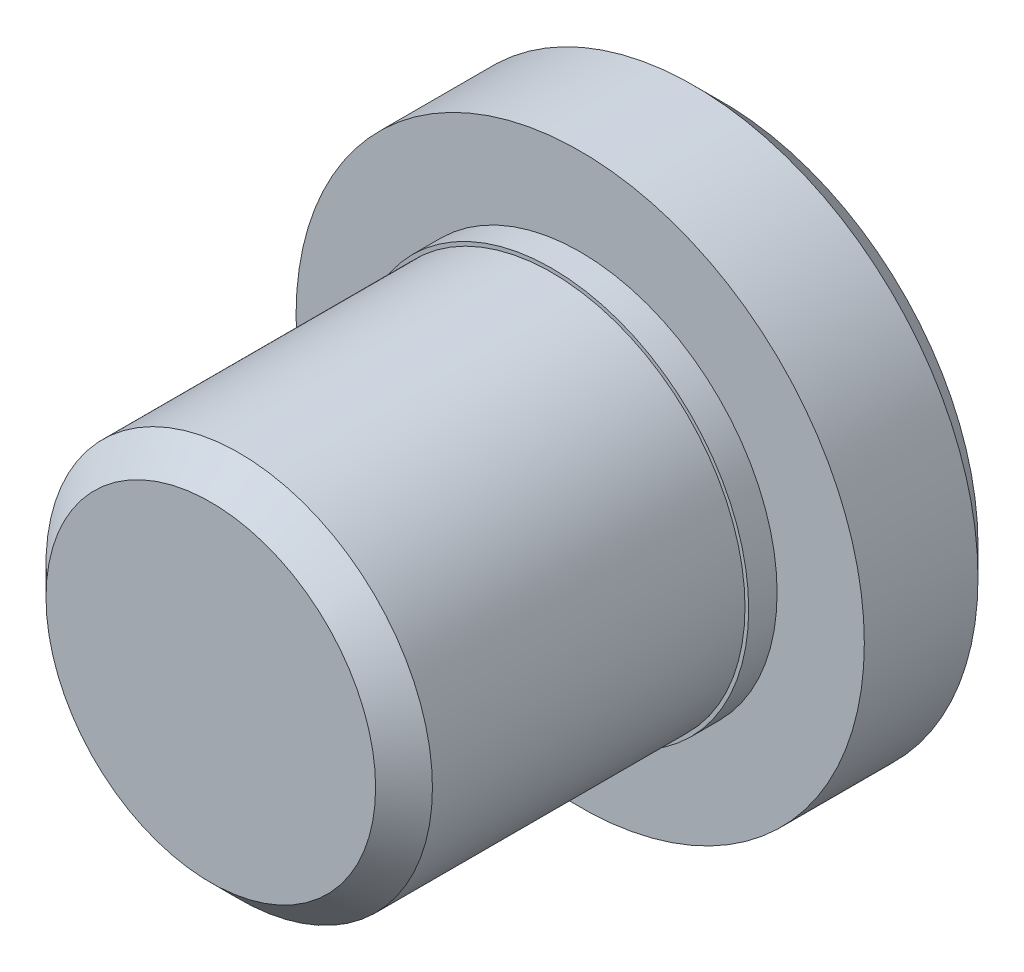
SolidWorks part; units mm, degrees
ref_plane "Piano frontale" through (0, 0, 0) normal (0, 0, 1) x (1, 0, 0)
ref_plane "Piano superiore" through (0, 0, 0) normal (0, 1, 0) x (1, 0, 0)
ref_plane "Piano destro" through (0, 0, 0) normal (1, 0, 0) x (0, 0, -1)
sketch "Schizzo1" plane through (0, 0, 0) normal (0, 1, 0) x (1, 0, 0)
  line L0 (1.621, -7) -> (0, -7.9359)
  line L1 (0, -7.9359) -> (0, -9)
  line L2 (0, -9) -> (2.9, -9)
  line L3 (2.9, -9) -> (3.4, -8.5)
  line L4 (3.4, -8.5) -> (3.4, -3)
  line L5 (3.4, -3) -> (3.465, -3)
  line L6 (3.465, -3) -> (3.465, -2.5)
  line L7 (3.465, -2.5) -> (5, -2.5)
  line L8 (5, -2.5) -> (5, -0.5)
  line L9 (5, -0.5) -> (4.5, 0)
  line L10 (4.5, 0) -> (2, 0)
  line L11 (2, 0) -> (1.621, -0.379)
  line L12 (1.621, -0.379) -> (1.621, -7)
  line L13 (0, 0) -> (0, -9) construction
revolve "Rivoluzione1" add sketch "Schizzo1" angle 360 about L13
